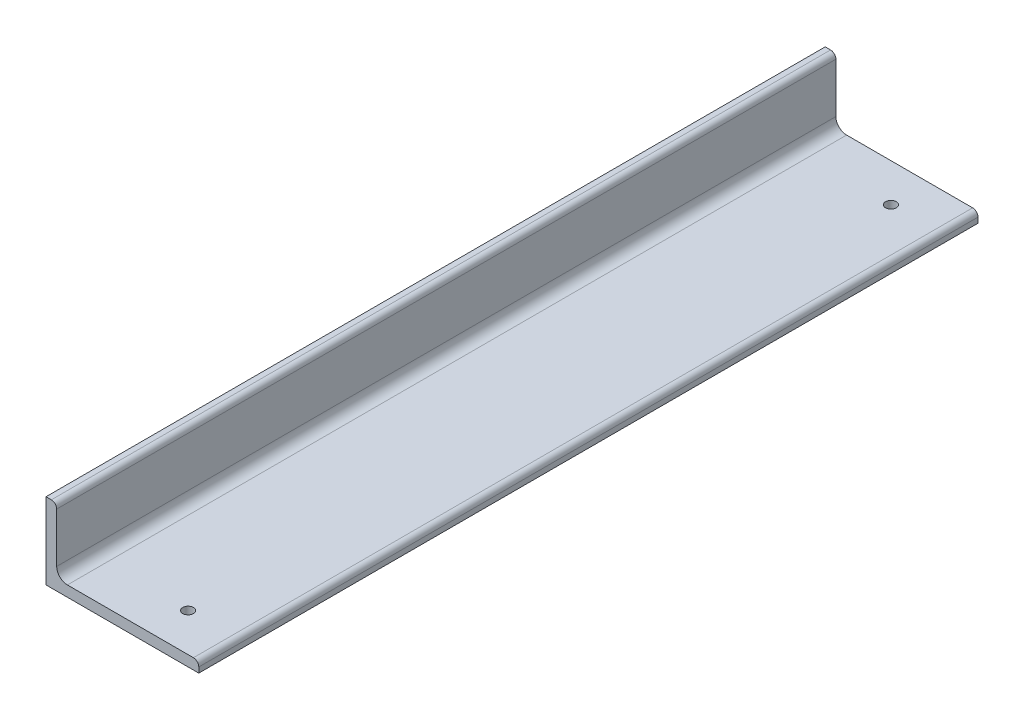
SolidWorks part; units mm, degrees
ref_plane "Face" through (0, 0, 0) normal (0, 0, 1) x (1, 0, 0)
ref_plane "Dessus" through (0, 0, 0) normal (0, 1, 0) x (1, 0, 0)
ref_plane "Droite" through (0, 0, 0) normal (1, 0, 0) x (0, 0, -1)
sketch "Esquisse1" plane through (0, 0, 0) normal (0, 0, 1) x (1, 0, 0)
  line L0 (0, 0) -> (0, 100)
  line L1 (0, 0) -> (200, 0)
  line L2 (0, 100) -> (7, 100)
  line L3 (14, 93) -> (14, 28)
  line L4 (28, 14) -> (193, 14)
  line L5 (200, 7) -> (200, 0)
  arc A0 (28, 14) -> (14, 28) centre (28, 28) cw
  arc A1 (14, 93) -> (7, 100) centre (7, 93) ccw
  arc A2 (200, 7) -> (193, 14) centre (193, 7) ccw
  dimension "D5" = 14
  dimension "D6" = 7
  dimension "D7" = 7
  dimension "D1" = 200
  dimension "D2" = 100
  dimension "D3" = 14
  dimension "D4" = 14
extrude "Extrusion1" add sketch "Esquisse1" along normal blind 1020
hole_wizard "Trou taraudé M16x1.51" positions "Esquisse3" profile "Esquisse2" tap size "M16x1.5" standard "Ansi Métrique"
sketch "Esquisse3" plane through (0, 0, 0) normal (0, -1, 0) x (1, 0, 0)
  line L0 (0, 1020) -> (0, 0) construction
  line L1 (0, 1020) -> (200, 1020) construction
  line L2 (0, 0) -> (200, 0) construction
  point P0 (136, 970)
  point P1 (136, 50)
  dimension "D1" = 136
  dimension "D2" = 136
  dimension "D3" = 50
  dimension "D4" = 50
  dimension "D5" = 920
sketch "Esquisse2" plane through (136, 0, 970) normal (1, 0, 0) x (0, 0, -1)
  line L0 (0, 0) -> (0, 39.206)
  line L1 (0, 39.206) -> (7, 35)
  line L2 (7, 35) -> (7, 0)
  line L5 (7, 0) -> (0, 0)
  line L10 (0, 39.206) -> (-7, 35) construction
  line L11 (0, -6.35) -> (0, 107.95) construction
  dimension "Diamètre du trou pour taraudage" = 14
  dimension "Profondeur du trou pour taraudage" = 35
  dimension "Angle de pointe" = 118
